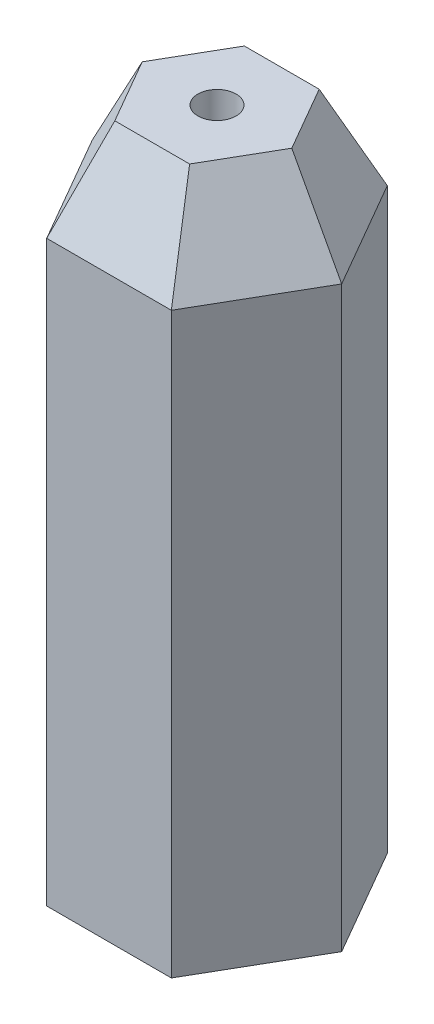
SolidWorks part; units mm, degrees
ref_plane "Front Plane" through (0, 0, 0) normal (0, 0, 1) x (1, 0, 0)
ref_plane "Top Plane" through (0, 0, 0) normal (0, 1, 0) x (1, 0, 0)
ref_plane "Right Plane" through (0, 0, 0) normal (1, 0, 0) x (0, 0, -1)
sketch "Sketch1" plane through (0, 0, 0) normal (0, 1, 0) x (1, 0, 0)
  line L1 (-8.6603, 0) -> (-4.3301, -7.5)
  line L2 (-4.3301, -7.5) -> (4.3301, -7.5)
  line L3 (4.3301, -7.5) -> (8.6603, 0)
  line L4 (8.6603, 0) -> (4.3301, 7.5)
  line L5 (4.3301, 7.5) -> (-4.3301, 7.5)
  line L6 (-4.3301, 7.5) -> (-8.6603, 0)
  circle A0 centre (0, 0) radius 7.5 construction
  circle A1 centre (0, 0) radius 1.325
  dimension "D2" = 2.65
  dimension "D1" = 15
extrude "Boss-Extrude1" add sketch "Sketch1" along normal blind 46.6
sketch "Sketch2" plane through (0, 46.6, 0) normal (0, 1, 0) x (1, 0, 0)
  circle A0 centre (0, 0) radius 1.325 construction
  circle A1 centre (0, 0) radius 1.325
extrude "Boss-Extrude2" add sketch "Sketch2" against normal offset from surface (22.6 mm away) 12 from offset 12
chamfer "Chamfer1" distance 3 angle 65 6 edges at (-6.4952, 46.6, 3.75) (-6.4952, 46.6, -3.75) (0, 46.6, -7.5) (6.4952, 46.6, -3.75) (6.4952, 46.6, 3.75) (0, 46.6, 7.5)
